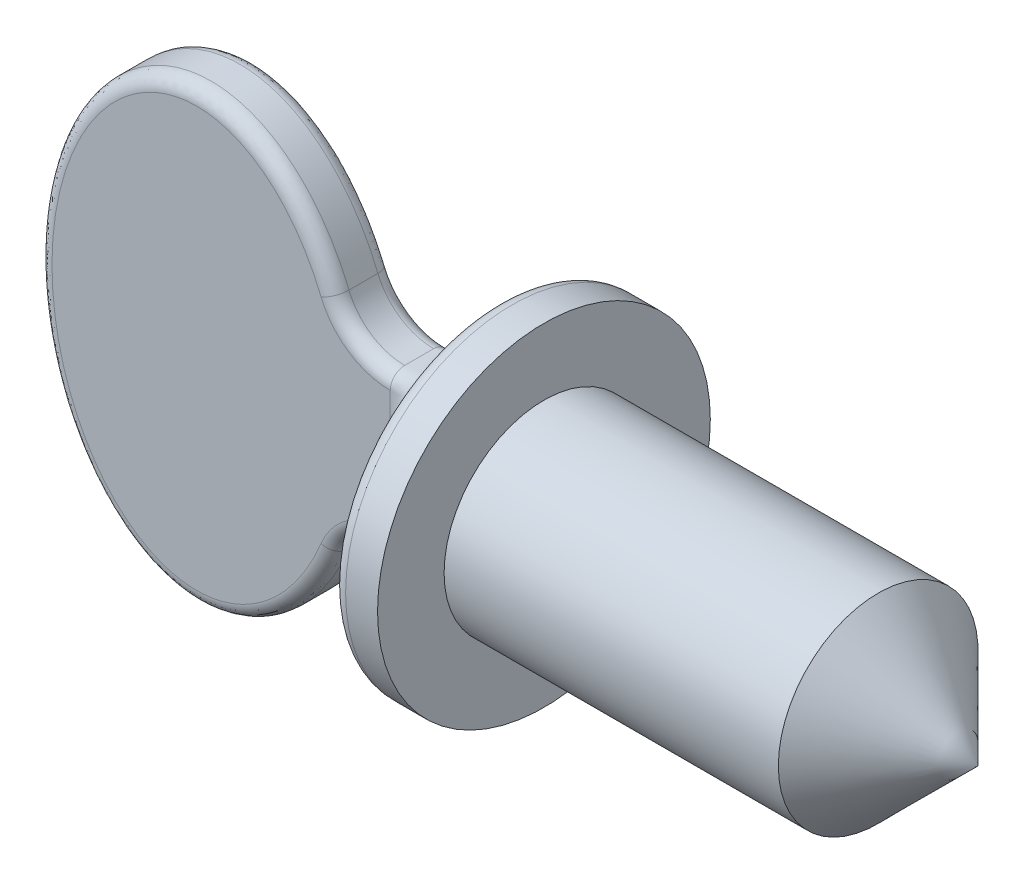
SolidWorks part; units mm, degrees
ref_plane "Front Plane" through (0, 0, 0) normal (0, 0, 1) x (1, 0, 0)
ref_plane "Top Plane" through (0, 0, 0) normal (0, 1, 0) x (1, 0, 0)
ref_plane "Right Plane" through (0, 0, 0) normal (1, 0, 0) x (0, 0, -1)
sketch "layout" plane through (0, 0, 0) normal (0, 0, 1) x (1, 0, 0)
  line L0 (0, 0) -> (13.208, 0) construction
  line L1 (5.588, 2.921) -> (5.588, -2.921)
  line L2 (3.3976, 1.3123) -> (4.8921, 1.3123) construction
  line L3 (5.588, 2.921) -> (4.7897, 2.921)
  line L4 (4.7897, 2.921) -> (4.7897, 3.2655) construction
  line L5 (4.2865, 1.706) -> (4.2865, 0)
  line L6 (4.2865, 1.706) -> (3.3355, 0.7551) construction
  line L7 (13.208, 1.7526) -> (13.208, 0)
  line L8 (3.3976, 1.3123) -> (3.3976, -1.3123)
  line L9 (13.208, 1.7526) -> (5.588, 1.7526)
  arc A0 (3.3976, 1.3123) -> (2.4197, 1.9685) centre (3.3976, 2.3692) cw
  arc A1 (4.7897, 2.921) -> (4.2865, 1.706) centre (3.0715, 2.921) cw
  arc A2 (3.3976, -1.3123) -> (2.4197, -1.9685) centre (3.3976, -2.3692) ccw
  ellipse E0 centre (0, 0) end of major axis (0, 3.937) minor radius 2.794 (2.4197, 1.9685) -> (2.4197, -1.9685) ccw
sketch "Sketch3" plane through (0, 0, 0) normal (0, 0, 1) x (1, 0, 0)
  line L0 (3.3976, 1.3123) -> (3.3976, -1.3123) construction
  line L1 (3.3976, 1.3123) -> (3.3976, -1.3123)
  arc A0 (3.3976, -1.3123) -> (2.4197, -1.9685) centre (3.3976, -2.3692) ccw construction
  arc A1 (2.4197, 1.9685) -> (3.3976, 1.3123) centre (3.3976, 2.3692) ccw construction
  arc A2 (3.3976, -1.3123) -> (2.4197, -1.9685) centre (3.3976, -2.3692) ccw
  arc A3 (2.4197, 1.9685) -> (3.3976, 1.3123) centre (3.3976, 2.3692) ccw
  ellipse E0 centre (0, 0) end of major axis (0, 3.937) minor radius 2.794 (2.4197, 1.9685) -> (2.4197, -1.9685) ccw construction
  ellipse E1 centre (0, 0) end of major axis (0, 3.937) minor radius 2.794 (2.4197, 1.9685) -> (2.4197, -1.9685) ccw
extrude "Extrude1" add sketch "Sketch3" along normal mid plane 1.016
fillet "Fillet1" radius 0.254 6 edges at (2.8088, 1.4916, -0.508) (2.8088, -1.4916, -0.508) (2.8088, 1.4916, 0.508) (2.8088, -1.4916, 0.508) (-2.794, 0, -0.508) (-2.794, 0, 0.508)
sketch "Sketch4" plane through (0, 0, 0) normal (0, 0, 1) x (1, 0, 0)
  line L0 (13.208, 1.7526) -> (13.208, 0) construction
  line L1 (13.208, 1.7526) -> (5.588, 1.7526) construction
  line L2 (5.588, 2.921) -> (5.588, -2.921) construction
  line L3 (5.588, 2.921) -> (4.7897, 2.921) construction
  line L4 (4.2865, 1.706) -> (4.2865, 0) construction
  line L5 (13.208, 1.7526) -> (13.208, 0) construction
  line L6 (11.4554, 1.7526) -> (5.588, 1.7526)
  line L7 (5.588, 2.921) -> (5.588, 1.7526)
  line L8 (5.588, 2.921) -> (4.7897, 2.921)
  line L9 (4.2865, 1.706) -> (4.2865, 0)
  line L10 (0, 0) -> (16.8942, 0) construction
  line L11 (13.208, 0) -> (4.2865, 0)
  line L12 (13.208, 0) -> (11.4554, 1.7526)
  line L13 (13.208, 0) -> (11.4554, -1.7526) construction
  arc A0 (4.2865, 1.706) -> (4.7897, 2.921) centre (3.0715, 2.921) ccw construction
  arc A1 (4.2865, 1.706) -> (4.7897, 2.921) centre (3.0715, 2.921) ccw
  dimension "D1" = 90
revolve "Revolve1" add sketch "Sketch4" angle 360 about L10
loft "Loft1" add
fillet "Fillet2" radius 0.254 1 edges at (4.7897, 0, 2.921)
sketch "Sketch5" plane through (0, 0, 0) normal (0, 1, 0) x (1, 0, 0)
  line L0 (10.9099, 2.2981) -> (11.4554, 2.2981)
  line L1 (11.4554, 2.2981) -> (11.4554, 1.7526)
  line L2 (11.4554, 1.7526) -> (11.1826, 1.2802)
  line L3 (11.1826, 1.2802) -> (10.9099, 1.7526)
  line L5 (10.9099, 1.7526) -> (10.9099, 2.2981)
  line L6 (11.4554, -1.7526) -> (11.4554, 1.7526) construction
  line L7 (-3.6147, 0) -> (14.1406, 0) construction
  line L8 (11.4554, 1.7526) -> (5.588, 1.7526) construction
revolve "Cut-Revolve10" [suppressed] cut sketch "Sketch5" angle 360 about L7
pattern_linear "LPattern10" [suppressed] count 7 along (1, 0, 0)
equation "\"D4@layout\" = \"Head Height@layout\" / 3 * 2"
equation "\"D5@layout\" = \"Head Width@layout\" / 3"
equation "\"D6@layout\" = \"Head Width@layout\" / 2"
equation "\"D7@layout\" = \"D5@layout\" * 1.3"
equation "\"D8@layout\" = \"D4@layout\"  / 7"
equation "\"D1@Fillet1\" = \"Head Thickness@Extrude1\" / 4"
equation "\"D1@Fillet2\" = \"D1@Fillet1\""
equation "\"D1@Sketch5\" = ( \"Base Screw Dia@layout\"- \"Minor Dia@Cosmetic Thread1\" )  / 2"
equation "\"D1@LPattern10\" = int((\"Length@layout\"-\"Base Screw Dia@layout\"/2)/\"Advance@LPattern10\")"
